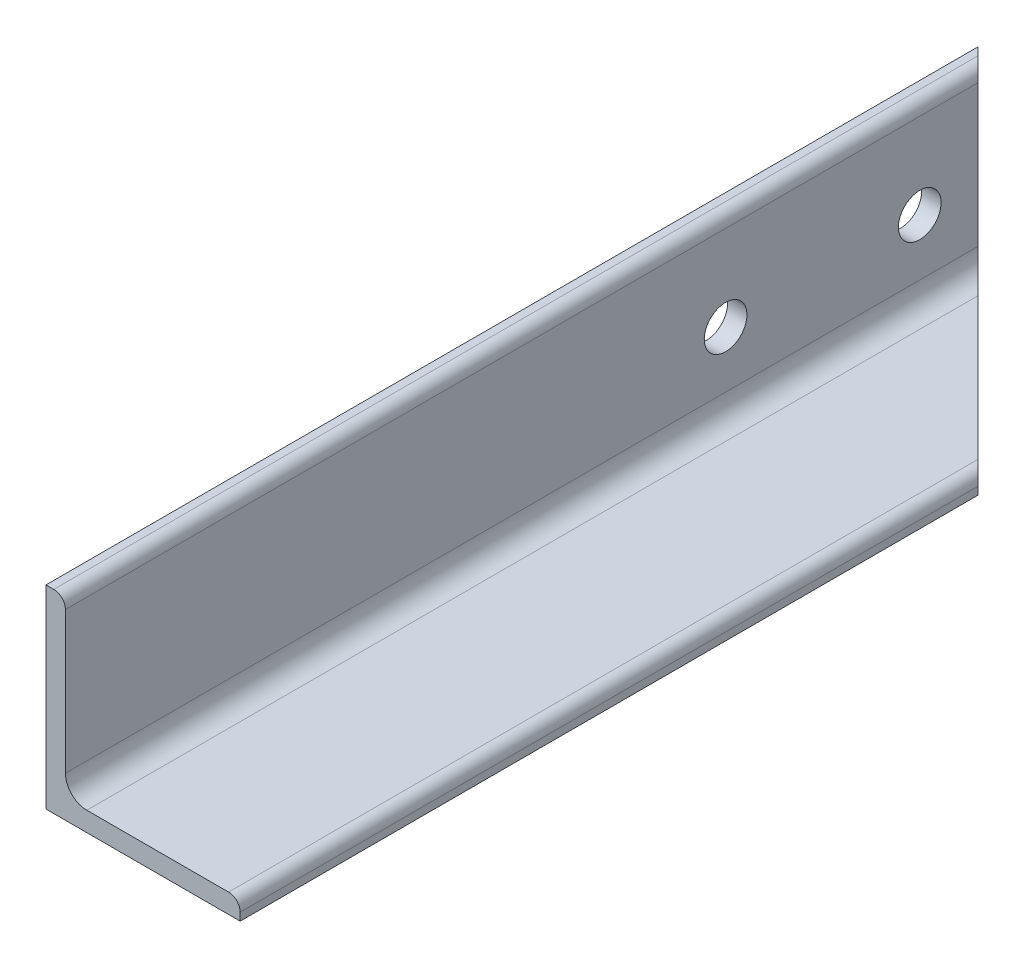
SolidWorks part; units mm, degrees
ref_plane "前视基准面" through (0, 0, 0) normal (0, 0, 1) x (1, 0, 0)
ref_plane "上视基准面" through (0, 0, 0) normal (0, 1, 0) x (1, 0, 0)
ref_plane "右视基准面" through (0, 0, 0) normal (1, 0, 0) x (0, 0, -1)
sketch "草图1" plane through (0, 0, 0) normal (0, 0, 1) x (1, 0, 0)
  line L0 (0, 50) -> (0, 0)
  line L1 (0, 0) -> (50, 0)
  line L2 (50, 0) -> (50, 2)
  line L3 (47, 5) -> (10.5, 5)
  line L4 (5, 10.5) -> (5, 47)
  line L5 (2, 50) -> (0, 50)
  arc A0 (10.5, 5) -> (5, 10.5) centre (10.5, 10.5) cw
  arc A1 (5, 47) -> (2, 50) centre (2, 47) ccw
  arc A2 (50, 2) -> (47, 5) centre (47, 2) ccw
  point P12 (5, 50)
  point P15 (50, 5)
  dimension "D5" = 5.5
  dimension "D6" = 3
  dimension "D1" = 50
  dimension "D2" = 50
  dimension "D3" = 5
  dimension "D4" = 5
extrude "拉伸1" add sketch "草图1" along normal blind 240
sketch "草图2" plane through (0, 0, 0) normal (-1, 0, 0) x (0, 0, 1)
  line L0 (-22.1008, 25) -> (94.2424, 25) construction
  line L1 (240, 50) -> (0, 50) construction
  line L2 (0, 50) -> (0, 0) construction
  circle A0 centre (20, 25) radius 5.5
  circle A1 centre (70, 25) radius 5.5
  dimension "D2" = 11
  dimension "D3" = 11
  dimension "D4" = 20
  dimension "D5" = 50
  dimension "D1" = 25
extrude "切除-拉伸1" cut sketch "草图2" against normal blind 240
sketch "草图3" plane through (0, 0, 0) normal (0, -1, 0) x (1, 0, 0)
  line L0 (0, 0) -> (50, 0)
  line L1 (50, 0) -> (50, 50)
  line L2 (50, 240) -> (50, 0) construction
  line L3 (50, 50) -> (0, 0)
  dimension "D1" = 50
extrude "切除-拉伸2" cut sketch "草图3" against normal blind 240
